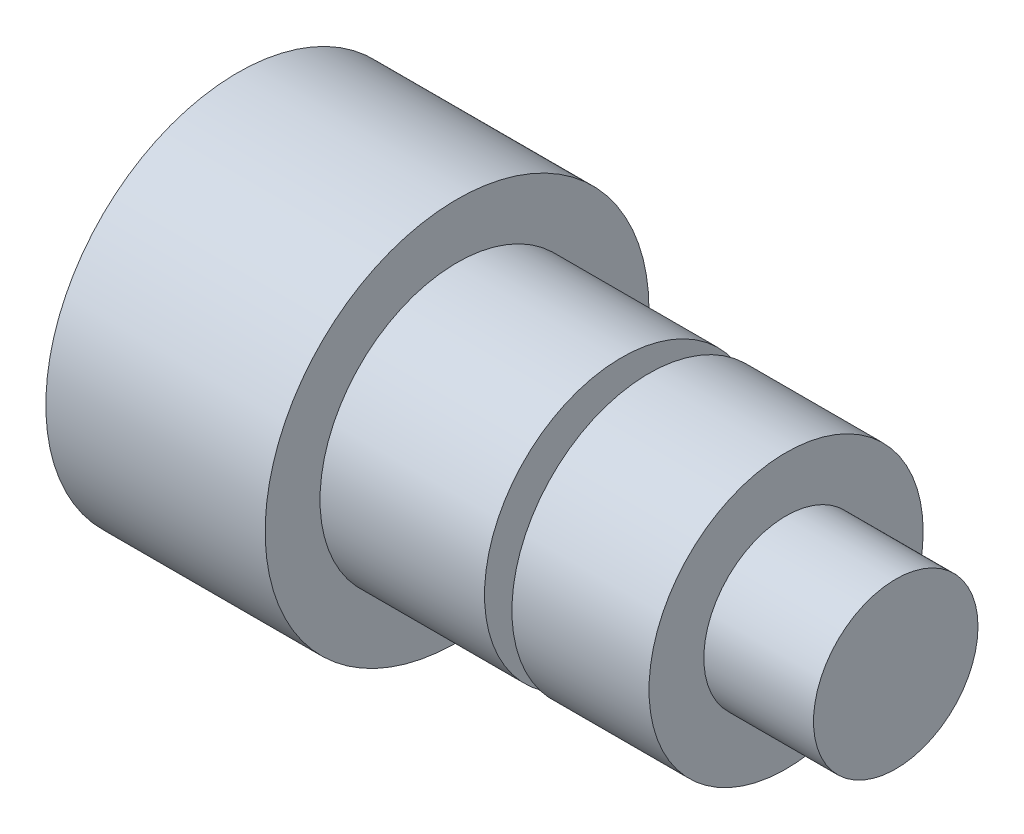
SolidWorks part; units mm, degrees
ref_plane "Plane1" through (0, 0, 0) normal (0, 0, 1) x (1, 0, 0)
ref_plane "Plane2" through (0, 0, 0) normal (0, 1, 0) x (1, 0, 0)
ref_plane "Plane3" through (0, 0, 0) normal (1, 0, 0) x (0, 0, -1)
sketch "Sketch1" plane through (0, 0, 0) normal (0, 0, 1) x (1, 0, 0)
  line L0 (0, 0) -> (0, 44.45)
  line L1 (0, 44.45) -> (50.8, 44.45)
  line L2 (50.8, 44.45) -> (50.8, 31.75)
  line L3 (50.8, 31.75) -> (88.9, 31.75)
  line L4 (88.9, 31.75) -> (88.9, 22.225)
  line L5 (88.9, 22.225) -> (95.25, 22.225)
  line L6 (95.25, 22.225) -> (95.25, 31.75)
  line L7 (95.25, 31.75) -> (127, 31.75)
  line L8 (127, 31.75) -> (127, 19.05)
  line L9 (127, 19.05) -> (152.4, 19.05)
  line L10 (152.4, 19.05) -> (152.4, 0)
  line L11 (152.4, 0) -> (0, 0)
  line L12 (213.7829, 0) -> (181.1873, 0) construction
  dimension "D1" = 88.9
  dimension "D2" = 63.5
  dimension "D3" = 44.45
  dimension "D4" = 38.1
  dimension "D5" = 50.8
  dimension "D6" = 88.9
  dimension "D7" = 6.35
  dimension "D8" = 31.75
  dimension "D9" = 25.4
revolve "Base-Revolve" add sketch "Sketch1" angle 360 about L12
